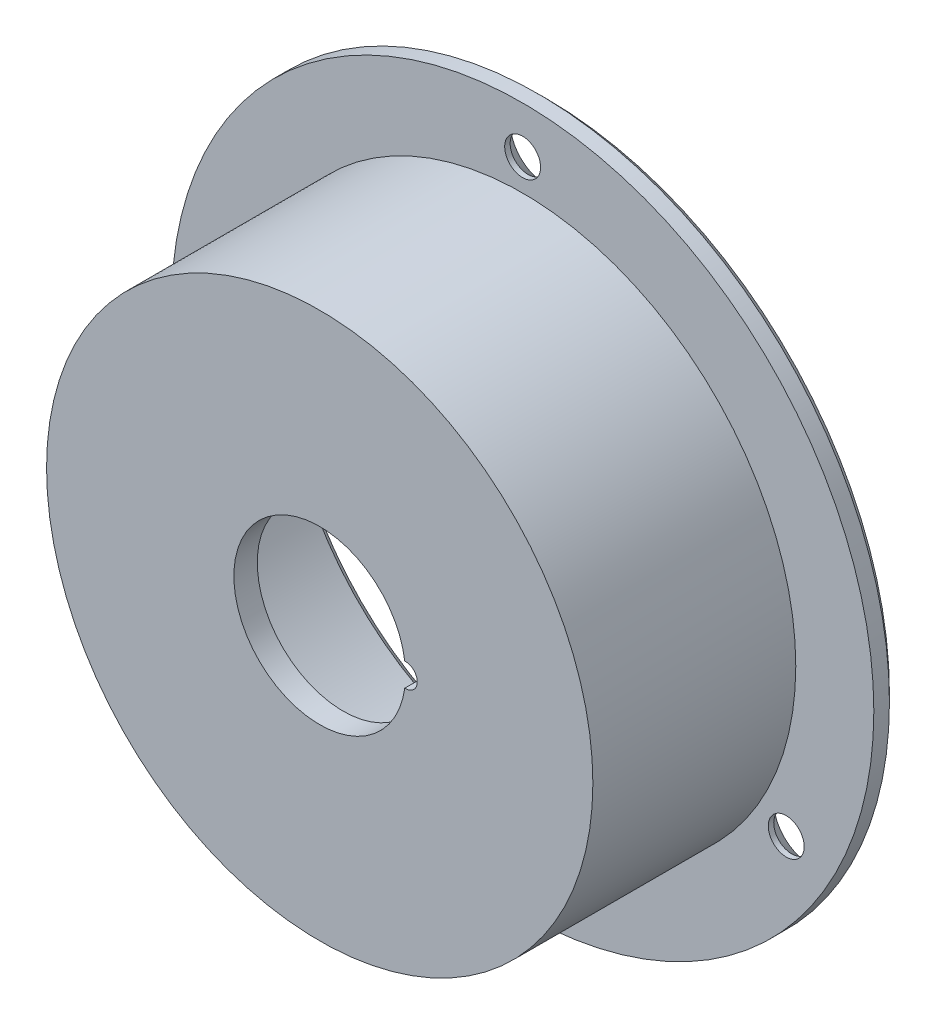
SolidWorks part; units mm, degrees
ref_plane "Przednia" through (0, 0, 0) normal (0, 0, 1) x (1, 0, 0)
ref_plane "Górna" through (0, 0, 0) normal (0, 1, 0) x (1, 0, 0)
ref_plane "Prawa" through (0, 0, 0) normal (1, 0, 0) x (0, 0, -1)
sketch "Szkic1" plane through (0, 0, 0) normal (0, 0, 1) x (1, 0, 0)
  circle A0 centre (0, 0) radius 45
  circle A1 centre (0, 0) radius 35
  dimension "D1" = 90
  dimension "D2" = 70
extrude "Dodanie-wyciągnięcie1" add sketch "Szkic1" along normal blind 3
sketch "Szkic2" plane through (0, 0, 3) normal (0, 0, 1) x (1, 0, 0)
  circle A0 centre (0, 0) radius 35
  circle A1 centre (0, 0) radius 32.5
  dimension "D1" = 65
extrude "Dodanie-wyciągnięcie2" add sketch "Szkic2" along normal blind 23 separate body
sketch "Szkic3" plane through (0, 0, 26) normal (0, 0, 1) x (1, 0, 0)
  circle A0 centre (0, 0) radius 35
extrude "Dodanie-wyciągnięcie3" add sketch "Szkic3" along normal blind 3
sketch "Szkic4" plane through (0, 0, 29) normal (0, 0, 1) x (1, 0, 0)
  circle A0 centre (0, 0) radius 11
  dimension "D1" = 22
extrude "Wytnij-wyciągnięcie1" cut sketch "Szkic4" against normal blind 3
sketch "Szkic5" plane through (0, 0, 3) normal (0, 0, -1) x (-1, 0, 0)
  circle A0 centre (0, 0) radius 35
extrude "Dodanie-wyciągnięcie4" add sketch "Szkic5" along normal blind 3
sketch "Szkic6" plane through (0, 0, 3) normal (0, 0, 1) x (1, 0, 0)
  circle A0 centre (0, 0) radius 32.5
  dimension "D1" = 65
extrude "Wytnij-wyciągnięcie2" cut sketch "Szkic6" against normal blind 3
chamfer "Sfazowanie1" distance 1 angle 45 2 edges at (45, 0, 0) (32.5, 0, 0)
sketch "Szkic7" plane through (0, 0, 3) normal (0, 0, 1) x (1, 0, 0)
  circle A0 centre (0, 39) radius 2.3
  circle A1 centre (0, 0) radius 11 construction
  dimension "D1" = 4.6
  dimension "D2" = 39
extrude "Wytnij-wyciągnięcie3" cut sketch "Szkic7" against normal blind 10
chamfer "Sfazowanie2" distance 2.3 angle 45 1 edges at (2.3, 39, 0)
pattern_circular "Szyk kołowy1" count 3 over 360 about axis through (0, 0, 0) along (0, 0, 1) of "Sfazowanie2", "Wytnij-wyciągnięcie3"
sketch "Szkic8" plane through (0, 0, 26) normal (0, 0, -1) x (-1, 0, 0)
  circle A0 centre (-11, 0) radius 1.5
  circle A1 centre (0, 0) radius 11 construction
  dimension "D1" = 3
extrude "Wytnij-wyciągnięcie4" cut sketch "Szkic8" against normal blind 10
